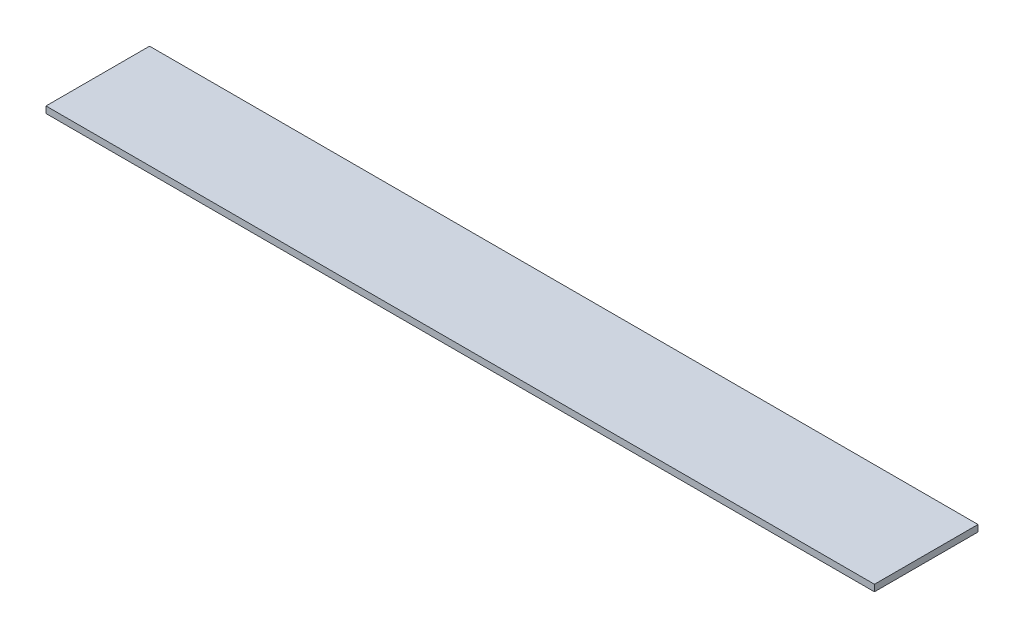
SolidWorks part; units mm, degrees
ref_plane "Front Plane" through (0, 0, 0) normal (0, 0, 1) x (1, 0, 0)
ref_plane "Top Plane" through (0, 0, 0) normal (0, 1, 0) x (1, 0, 0)
ref_plane "Right Plane" through (0, 0, 0) normal (1, 0, 0) x (0, 0, -1)
sketch "Sketch1" plane through (0, 0, 0) normal (0, 1, 0) x (1, 0, 0)
  line L1 (0, 0) -> (400, 0)
  line L2 (0, 0) -> (0, 50)
  line L3 (0, 50) -> (400, 50)
  line L4 (400, 0) -> (400, 50)
  dimension "D1" = 400
  dimension "D2" = 50
extrude "Boss-Extrude1" add sketch "Sketch1" along normal blind 3.175
